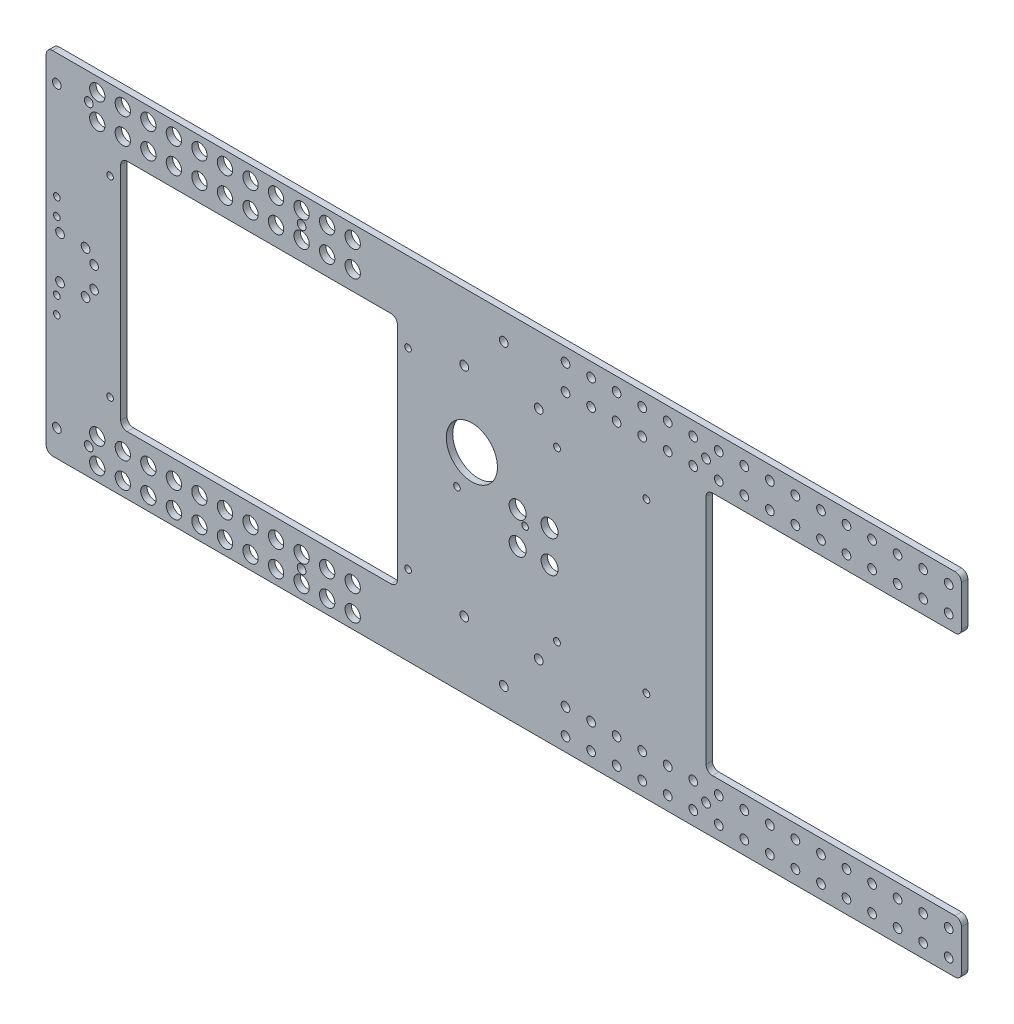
SolidWorks part; units mm, degrees
ref_plane "前视基准面" through (0, 0, 0) normal (0, 0, 1) x (1, 0, 0)
ref_plane "上视基准面" through (0, 0, 0) normal (0, 1, 0) x (1, 0, 0)
ref_plane "右视基准面" through (0, 0, 0) normal (1, 0, 0) x (0, 0, -1)
sketch "草图1" plane through (0, 0, 0) normal (0, 0, 1) x (1, 0, 0)
  line L0 (0, 0) -> (-90.2536, 0) construction
  line L1 (-215, -82.5) -> (215, -82.5)
  line L2 (-215, -82.5) -> (-215, 82.5)
  line L3 (-215, 82.5) -> (215, 82.5)
  line L4 (215, -82.5) -> (215, 82.5)
  line L5 (-215, -82.5) -> (215, 82.5) construction
  line L6 (-215, 82.5) -> (215, -82.5) construction
  line L7 (0, 0) -> (0, 47.3041) construction
  line L8 (-210, 70) -> (190, 70) construction
  circle A0 centre (-210, 70) radius 2.05
  circle A1 centre (209, 76) radius 2.05
  circle A2 centre (209, 64) radius 2.05
  circle A3 centre (-210, -70) radius 2.05
  circle A4 centre (-195, 70) radius 2.05
  circle A5 centre (209, -64) radius 2.05
  circle A6 centre (-195, -70) radius 2.05
  circle A7 centre (209, -76) radius 2.05
  circle A8 centre (197, 76) radius 2.05
  circle A9 centre (197, 64) radius 2.05
  circle A10 centre (197, -64) radius 2.05
  circle A11 centre (197, -76) radius 2.05
  circle A12 centre (190, 70) radius 2.05
  circle A13 centre (190, -70) radius 2.05
  circle A14 centre (185, 76) radius 2.05
  circle A15 centre (185, 64) radius 2.05
  circle A16 centre (185, -64) radius 2.05
  circle A17 centre (185, -76) radius 2.05
  circle A18 centre (173, 76) radius 2.05
  circle A19 centre (173, 64) radius 2.05
  circle A20 centre (173, -64) radius 2.05
  circle A21 centre (173, -76) radius 2.05
  circle A22 centre (161, 76) radius 2.05
  circle A23 centre (161, 64) radius 2.05
  circle A24 centre (161, -64) radius 2.05
  circle A25 centre (161, -76) radius 2.05
  circle A26 centre (149, 76) radius 2.05
  circle A27 centre (149, 64) radius 2.05
  circle A28 centre (149, -64) radius 2.05
  circle A29 centre (149, -76) radius 2.05
  circle A30 centre (137, 76) radius 2.05
  circle A31 centre (137, 64) radius 2.05
  circle A32 centre (137, -64) radius 2.05
  circle A33 centre (137, -76) radius 2.05
  circle A34 centre (125, 76) radius 2.05
  circle A35 centre (125, 64) radius 2.05
  circle A36 centre (125, -64) radius 2.05
  circle A37 centre (125, -76) radius 2.05
  circle A38 centre (113, 76) radius 2.05
  circle A39 centre (113, 64) radius 2.05
  circle A40 centre (113, -64) radius 2.05
  circle A41 centre (113, -76) radius 2.05
  circle A42 centre (101, 76) radius 2.05
  circle A43 centre (101, 64) radius 2.05
  circle A44 centre (101, -64) radius 2.05
  circle A45 centre (101, -76) radius 2.05
  circle A46 centre (89, 76) radius 2.05
  circle A47 centre (89, 64) radius 2.05
  circle A48 centre (89, -64) radius 2.05
  circle A49 centre (89, -76) radius 2.05
  circle A50 centre (77, 76) radius 2.05
  circle A51 centre (77, 64) radius 2.05
  circle A52 centre (77, -64) radius 2.05
  circle A53 centre (77, -76) radius 2.05
  circle A54 centre (65, 76) radius 2.05
  circle A55 centre (65, 64) radius 2.05
  circle A56 centre (65, -64) radius 2.05
  circle A57 centre (65, -76) radius 2.05
  circle A58 centre (53, 76) radius 2.05
  circle A59 centre (53, 64) radius 2.05
  circle A60 centre (53, -64) radius 2.05
  circle A61 centre (53, -76) radius 2.05
  circle A62 centre (41, 76) radius 2.05
  circle A63 centre (41, 64) radius 2.05
  circle A64 centre (41, -64) radius 2.05
  circle A65 centre (41, -76) radius 2.05
  circle A66 centre (29, 76) radius 2.05
  circle A67 centre (29, 64) radius 2.05
  circle A68 centre (29, -64) radius 2.05
  circle A69 centre (29, -76) radius 2.05
  circle A70 centre (-71, 76) radius 2.05
  circle A71 centre (-71, 64) radius 2.05
  circle A72 centre (-71, -64) radius 2.05
  circle A73 centre (-71, -76) radius 2.05
  circle A74 centre (-83, 76) radius 2.05
  circle A75 centre (-83, 64) radius 2.05
  circle A76 centre (-83, -64) radius 2.05
  circle A77 centre (-83, -76) radius 2.05
  circle A78 centre (-95, 76) radius 2.05
  circle A79 centre (-95, 64) radius 2.05
  circle A80 centre (-95, -64) radius 2.05
  circle A81 centre (-95, -76) radius 2.05
  circle A82 centre (-107, 76) radius 2.05
  circle A83 centre (-107, 64) radius 2.05
  circle A84 centre (-107, -64) radius 2.05
  circle A85 centre (-107, -76) radius 2.05
  circle A86 centre (-119, 76) radius 2.05
  circle A87 centre (-119, 64) radius 2.05
  circle A88 centre (-119, -64) radius 2.05
  circle A89 centre (-119, -76) radius 2.05
  circle A90 centre (-131, 76) radius 2.05
  circle A91 centre (-131, 64) radius 2.05
  circle A92 centre (-131, -64) radius 2.05
  circle A93 centre (-131, -76) radius 2.05
  circle A94 centre (-143, 76) radius 2.05
  circle A95 centre (-143, 64) radius 2.05
  circle A96 centre (-143, -64) radius 2.05
  circle A97 centre (-143, -76) radius 2.05
  circle A98 centre (-155, 76) radius 2.05
  circle A99 centre (-155, 64) radius 2.05
  circle A100 centre (-155, -64) radius 2.05
  circle A101 centre (-155, -76) radius 2.05
  circle A102 centre (-167, 76) radius 2.05
  circle A103 centre (-167, 64) radius 2.05
  circle A104 centre (-167, -64) radius 2.05
  circle A105 centre (-167, -76) radius 2.05
  circle A106 centre (-179, 76) radius 2.05
  circle A107 centre (-179, 64) radius 2.05
  circle A108 centre (-179, -64) radius 2.05
  circle A109 centre (-179, -76) radius 2.05
  circle A110 centre (-191, 76) radius 2.05
  circle A111 centre (-191, 64) radius 2.05
  circle A112 centre (-191, -64) radius 2.05
  circle A113 centre (-191, -76) radius 2.05
  point P0 (0, 0)
  dimension "D3" = 4.1
  dimension "D4" = 5
  dimension "D5" = 140
  dimension "D8" = 4.1
  dimension "D9" = 15
  dimension "D10" = 4.1
  dimension "D11" = 6
  dimension "D12" = 6
  dimension "D13" = 16
  dimension "D14" = 2
  dimension "D1" = 165
  dimension "D2" = 430
  dimension "D6" = 2
  dimension "D7" = 2
  dimension "D15" = 8
  dimension "D16" = 4
extrude "凸台-拉伸1" add sketch "草图1" along normal blind 3
sketch "草图2" plane through (0, 0, 3) normal (0, 0, 1) x (1, 0, 0)
  line L0 (14, -2.5) -> (14, 16.8836) construction
  line L1 (-31, 55) -> (79, 55) construction
  line L2 (-31, 55) -> (-31, -55) construction
  line L3 (-31, -55) -> (79, -55) construction
  line L4 (79, 55) -> (79, -55) construction
  line L5 (-31, 55) -> (79, -55) construction
  line L6 (-31, -55) -> (79, 55) construction
  line L7 (14, -2.5) -> (-5.3634, -2.5) construction
  circle A0 centre (6.5, 5) radius 4
  circle A1 centre (-15, 17.5) radius 12
  circle A2 centre (21.5, 5) radius 4
  circle A3 centre (21.5, -10) radius 4
  circle A4 centre (6.5, -10) radius 4
  point P0 (24, 0)
  point P22 (14, -2.5)
  dimension "D4" = 8
  dimension "D5" = 15
  dimension "D6" = 45
  dimension "D7" = 24
  dimension "D8" = 37.5
  dimension "D9" = 16
  dimension "D10" = 15
  dimension "D11" = 4
  dimension "D1" = 24
  dimension "D2" = 110
  dimension "D3" = 110
extrude "切除-拉伸1" cut sketch "草图2" against normal blind 25.001
sketch "草图3" plane through (0, 0, 3) normal (0, 0, 1) x (1, 0, 0)
  line L0 (-215, 0) -> (215, 0) construction
  line L1 (-215, 82.5) -> (-215, -82.5) construction
  line L2 (215, -82.5) -> (215, 82.5) construction
  line L3 (-202.5, 115.4558) -> (-202.5, -138.2217) construction
  line L5 (-180, -55) -> (-50, -55)
  line L6 (-180, -55) -> (-180, 55)
  line L7 (-180, 55) -> (-50, 55)
  line L8 (-50, -55) -> (-50, 55)
  line L9 (-180, -55) -> (-50, 55) construction
  line L10 (-180, 55) -> (-50, -55) construction
  circle A0 centre (-208.5, 10) radius 2.05
  circle A1 centre (-196.5, 10) radius 2.05
  circle A2 centre (-196.5, -10) radius 2.05
  circle A3 centre (-208.5, -10) radius 2.05
  circle A4 centre (-22, 0) radius 1.55
  circle A5 centre (10, 0) radius 1.55
  point P10 (-115, 0)
  dimension "D2" = 4.1
  dimension "D3" = 20
  dimension "D4" = 12
  dimension "D5" = 2
  dimension "D10" = 3.1
  dimension "D11" = 3.1
  dimension "D12" = 32
  dimension "D13" = 193
  dimension "D1" = 12.5
  dimension "D7" = 110
  dimension "D8" = 130
  dimension "D9" = 100
  dimension "D6" = 2
extrude "切除-拉伸2" cut sketch "草图3" against normal blind 10
sketch "草图4" plane through (0, 0, 3) normal (0, 0, 1) x (1, 0, 0)
  line L0 (-215, 0) -> (-180, 0) construction
  line L1 (-215, 82.5) -> (-215, -82.5) construction
  line L2 (-180, 55) -> (-180, -55) construction
  circle A0 centre (-192.5, 5) radius 2
  circle A1 centre (-192.5, -5) radius 2
  dimension "D1" = 4
  dimension "D2" = 12.5
  dimension "D3" = 5
extrude "切除-拉伸3" cut sketch "草图4" against normal blind 5
sketch "草图5" plane through (0, 0, 3) normal (0, 0, 1) x (1, 0, 0)
  line L0 (215, -82.5) -> (215, 82.5) construction
  line L1 (95, -57.5) -> (335, -57.5)
  line L2 (95, -57.5) -> (95, 57.5)
  line L3 (95, 57.5) -> (335, 57.5)
  line L4 (335, -57.5) -> (335, 57.5)
  line L5 (95, -57.5) -> (335, 57.5) construction
  line L6 (95, 57.5) -> (335, -57.5) construction
  line L7 (215, 82.5) -> (-215, 82.5) construction
  point P0 (215, 0)
  dimension "D1" = 25
  dimension "D2" = 120
extrude "切除-拉伸4" cut sketch "草图5" against normal blind 10
sketch "草图7" plane through (0, 0, 3) normal (0, 0, 1) x (1, 0, 0)
  line L0 (-210, -70) -> (215, -70) construction
  line L1 (215, -82.5) -> (215, -57.5) construction
  line L2 (-215, 82.5) -> (-215, -82.5) construction
  line L3 (0, 0) -> (95, 0) construction
  line L4 (95, 57.5) -> (95, -57.5) construction
  circle A0 centre (-95, -70) radius 2.05
  circle A1 centre (0, -70) radius 2.05
  circle A2 centre (95, -70) radius 2.05
  circle A3 centre (95, 70) radius 2.05
  circle A4 centre (0, 70) radius 2.05
  circle A5 centre (-95, 70) radius 2.05
  dimension "D1" = 4.1
  dimension "D2" = 120
  dimension "D3" = 3
extrude "切除-拉伸5" cut sketch "草图7" against normal blind 66
sketch "草图8" plane through (0, 0, 3) normal (0, 0, 1) x (1, 0, 0)
  line L0 (0, 0) -> (252.3495, 0) construction
  line L1 (-215, 82.5) -> (-215, -82.5) construction
  circle A0 centre (25, 39.5) radius 1.6
  circle A1 centre (67, 39.5) radius 1.6
  circle A2 centre (67, -39.5) radius 1.6
  circle A3 centre (25, -39.5) radius 1.6
  dimension "D1" = 3.2
  dimension "D2" = 79
  dimension "D3" = 240
  dimension "D4" = 2
  dimension "D5" = 2
extrude "切除-拉伸6" cut sketch "草图8" against normal blind 10
sketch "草图9" plane through (0, 0, 3) normal (0, 0, 1) x (1, 0, 0)
  line L0 (-103.127, 45) -> (44.0847, 45) construction
  line L1 (0, 0) -> (-137.9595, 0) construction
  line L2 (-50, 55) -> (-180, 55) construction
  line L3 (-50, -55) -> (-50, 55) construction
  line L4 (-115, 55) -> (-115, -55) construction
  line L5 (-180, -55) -> (-50, -55) construction
  circle A0 centre (-45, 45) radius 1.55
  circle A1 centre (-185, -45) radius 1.55
  circle A2 centre (-45, -45) radius 1.55
  circle A3 centre (-185, 45) radius 1.55
  dimension "D1" = 3.1
  dimension "D3" = 10
  dimension "D4" = 5
extrude "切除-拉伸7" cut sketch "草图9" against normal blind 10
sketch "草图10" plane through (0, 0, 0) normal (0, 0, -1) x (-1, 0, 0)
  line L0 (215, 0) -> (-132.6011, 0) construction
  line L1 (215, 82.5) -> (215, -82.5) construction
  line L2 (210, 0) -> (210, 54.0834) construction
  circle A0 centre (210, 16) radius 1.55
  circle A1 centre (210, 24) radius 1.55
  circle A2 centre (210, -16) radius 1.55
  circle A3 centre (210, -24) radius 1.55
  dimension "D2" = 3.1
  dimension "D3" = 16
  dimension "D4" = 8
  dimension "D1" = 5
extrude "切除-拉伸8" cut sketch "草图10" against normal blind 10
sketch "草图11" plane through (0, 0, 3) normal (0, 0, 1) x (1, 0, 0)
  line L0 (95, 0) -> (-215, 0) construction
  line L1 (95, 57.5) -> (95, -57.5) construction
  line L2 (-215, 82.5) -> (-215, -82.5) construction
  circle A0 centre (-18.5937, 51) radius 2.05
  circle A1 centre (16.4063, 51) radius 2.05
  circle A2 centre (16.4063, -51) radius 2.05
  circle A3 centre (-18.5937, -51) radius 2.05
  dimension "D1" = 4.1
  dimension "D2" = 102
  dimension "D3" = 2
  dimension "D4" = 2
extrude "切除-拉伸9" cut sketch "草图11" against normal up to surface (3 mm away)
sketch "草图12" plane through (0, 0, 3) normal (0, 0, 1) x (1, 0, 0)
  circle A0 centre (-191, 76) radius 3.6
  circle A1 centre (-191, 64) radius 3.6
  circle A2 centre (-191, -64) radius 3.6
  circle A3 centre (-191, -76) radius 3.6
  circle A4 centre (-179, 76) radius 3.6
  circle A5 centre (-179, 64) radius 3.6
  circle A6 centre (-179, -64) radius 3.6
  circle A7 centre (-179, -76) radius 3.6
  circle A8 centre (-167, 76) radius 3.6
  circle A9 centre (-167, 64) radius 3.6
  circle A10 centre (-167, -64) radius 3.6
  circle A11 centre (-167, -76) radius 3.6
  circle A12 centre (-155, 76) radius 3.6
  circle A13 centre (-155, 64) radius 3.6
  circle A14 centre (-155, -64) radius 3.6
  circle A15 centre (-155, -76) radius 3.6
  circle A16 centre (-143, 76) radius 3.6
  circle A17 centre (-143, 64) radius 3.6
  circle A18 centre (-143, -64) radius 3.6
  circle A19 centre (-143, -76) radius 3.6
  circle A20 centre (-131, 76) radius 3.6
  circle A21 centre (-131, 64) radius 3.6
  circle A22 centre (-131, -64) radius 3.6
  circle A23 centre (-131, -76) radius 3.6
  circle A24 centre (-119, 76) radius 3.6
  circle A25 centre (-119, 64) radius 3.6
  circle A26 centre (-119, -64) radius 3.6
  circle A27 centre (-119, -76) radius 3.6
  circle A28 centre (-107, 76) radius 3.6
  circle A29 centre (-107, 64) radius 3.6
  circle A30 centre (-107, -64) radius 3.6
  circle A31 centre (-107, -76) radius 3.6
  circle A32 centre (-95, 76) radius 3.6
  circle A33 centre (-95, 64) radius 3.6
  circle A34 centre (-95, -64) radius 3.6
  circle A35 centre (-95, -76) radius 3.6
  circle A36 centre (-83, 76) radius 3.6
  circle A37 centre (-83, 64) radius 3.6
  circle A38 centre (-83, -64) radius 3.6
  circle A39 centre (-83, -76) radius 3.6
  circle A40 centre (-71, 76) radius 3.6
  circle A41 centre (-71, 64) radius 3.6
  circle A42 centre (-71, -64) radius 3.6
  circle A43 centre (-71, -76) radius 3.6
  dimension "D1" = 7.2
  dimension "D2" = 11
extrude "切除-拉伸10" cut sketch "草图12" against normal blind 10
fillet "圆角1" radius 3 12 edges at (215, 57.5, 1.5) (215, 82.5, 1.5) (215, -57.5, 1.5) (215, -82.5, 1.5) (95, 57.5, 1.5) (95, -57.5, 1.5) (-50, 55, 1.5) (-50, -55, 1.5) (-180, -55, 1.5) (-180, 55, 1.5) (-215, 82.5, 1.5) (-215, -82.5, 1.5)
